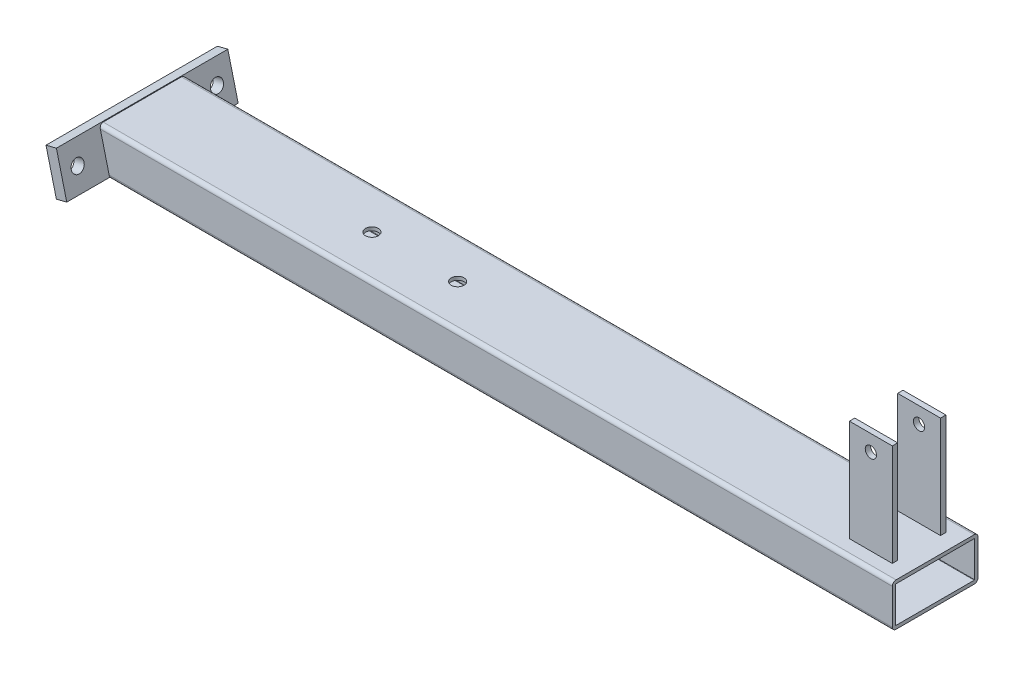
SolidWorks part; units mm, degrees
ref_plane "Plan de face" through (0, 0, 0) normal (0, 0, 1) x (1, 0, 0)
ref_plane "Plan de dessus" through (0, 0, 0) normal (0, 1, 0) x (1, 0, 0)
ref_plane "Plan de droite" through (0, 0, 0) normal (1, 0, 0) x (0, 0, -1)
sketch3d "Esquisse3D1"
  line L0 (0, 0, 0) -> (-740, 0, 0)
  dimension "D1" = 740
other "Elément mécano-soudé1"
ref_plane "Plan1" through (0, 0, 0) normal (-1, 0, 0) x (0, 1, 0)
sketch "Sketch1" plane through (0, 0, 0) normal (-1, 0, 0) x (0, 1, 0)
  line L0 (-16.5, -36.8) -> (16.5, -36.8)
  line L1 (-16.8, -36.5) -> (-16.8, 36.5)
  line L2 (16.5, 36.8) -> (-16.5, 36.8)
  line L3 (16.8, 36.5) -> (16.8, -36.5)
  line L4 (-16.5, -40) -> (16.5, -40)
  line L5 (-20, -36.5) -> (-20, 36.5)
  line L6 (16.5, 40) -> (-16.5, 40)
  line L7 (20, 36.5) -> (20, -36.5)
  arc A0 (20, 36.5) -> (16.5, 40) centre (16.5, 36.5) ccw
  arc A1 (16.5, -40) -> (20, -36.5) centre (16.5, -36.5) ccw
  arc A2 (-20, -36.5) -> (-16.5, -40) centre (-16.5, -36.5) ccw
  arc A3 (-16.5, 40) -> (-20, 36.5) centre (-16.5, 36.5) ccw
  arc A4 (-16.5, 36.8) -> (-16.8, 36.5) centre (-16.5, 36.5) ccw
  arc A5 (16.8, 36.5) -> (16.5, 36.8) centre (16.5, 36.5) ccw
  arc A6 (16.5, -36.8) -> (16.8, -36.5) centre (16.5, -36.5) ccw
  arc A7 (-16.8, -36.5) -> (-16.5, -36.8) centre (-16.5, -36.5) ccw
  point P0 (0, 40)
  point P1 (20, 0)
  point P2 (0, -40)
  point P3 (-20, 0)
  point P4 (-20, 40)
  point P5 (20, 40)
  point P6 (20, -40)
  point P7 (-20, -40)
  point P8 (0, 0)
  point P33 (0, 0)
  dimension "D1" = 3.5
  dimension "Thickness" = 3.2
  dimension "V_leg" = 80
  dimension "H_leg" = 40
ref_plane "Plan2" through (-691.9959, -172.534, 0) normal (-0.9703, -0.2419, 0) x (0, 0, 1)
sketch "Esquisse4" plane through (-691.9959, -172.534, 0) normal (-0.9703, -0.2419, 0) x (0, 0, 1)
  line L1 (-74.4268, 219.3458) -> (67.5126, 219.3458)
  line L2 (-74.4268, 219.3458) -> (-74.4268, 141.0246)
  line L3 (-74.4268, 141.0246) -> (67.5126, 141.0246)
  line L4 (67.5126, 219.3458) -> (67.5126, 141.0246)
extrude "Enlèv. mat.-Extru.1" cut sketch "Esquisse4" along normal blind 10
sketch "Esquisse5" plane through (-691.9959, -172.534, 0) normal (-0.9703, -0.2419, 0) x (0, 0, 1)
  line L1 (-80, 199.0222) -> (80, 199.0222)
  line L2 (-80, 199.0222) -> (-80, 159.0222)
  line L3 (-80, 159.0222) -> (80, 159.0222)
  line L4 (80, 199.0222) -> (80, 159.0222)
  circle A0 centre (-65, 179.0222) radius 6
  circle A1 centre (65, 179.0222) radius 6
  dimension "D5" = 12
  dimension "D1" = 160
  dimension "D2" = 40
  dimension "D3" = 20
  dimension "D4" = 80
  dimension "D6" = 65
  dimension "D7" = 65
extrude "Boss.-Extru.1" add sketch "Esquisse5" along normal blind 10 separate body
sketch "Esquisse6" plane through (0, 20, 0) normal (0, 1, 0) x (1, 0, 0)
  line L0 (0, -36.5) -> (0, 36.5) construction
  line L1 (-55, 25) -> (-15, 25)
  line L2 (-55, 25) -> (-55, 20)
  line L3 (-55, 20) -> (-15, 20)
  line L4 (-15, 25) -> (-15, 20)
  line L5 (-739.1274, 40) -> (0, 40) construction
  line L6 (0, 0) -> (-96.6797, 0) construction
  line L7 (-15, -25) -> (-15, -20)
  line L8 (-55, -25) -> (-15, -25)
  line L9 (-55, -25) -> (-55, -20)
  line L10 (-55, -20) -> (-15, -20)
  dimension "D1" = 40
  dimension "D2" = 5
  dimension "D3" = 15
  dimension "D4" = 15
extrude "Boss.-Extru.2" add sketch "Esquisse6" along normal blind 95 separate body
sketch "Esquisse7" plane through (0, 0, -20) normal (0, 0, 1) x (1, 0, 0)
  line L0 (-55, 115) -> (-55, 20) construction
  line L1 (-55, 115) -> (-15, 115) construction
  circle A0 centre (-35, 100) radius 5.25
  dimension "D3" = 10.5
  dimension "D1" = 20
  dimension "D2" = 15
extrude "Enlèv. mat.-Extru.2" cut sketch "Esquisse7" against normal through all and the other way through all
sketch "Esquisse8" plane through (0, -20, 0) normal (0, -1, 0) x (1, 0, 0)
  circle A0 centre (-445.6439, 0) radius 6
  circle A1 centre (-525.6439, 0) radius 6
  dimension "D3" = 12
  dimension "D2" = 80
extrude "Enlèv. mat.-Extru.3" cut sketch "Esquisse8" against normal through all
